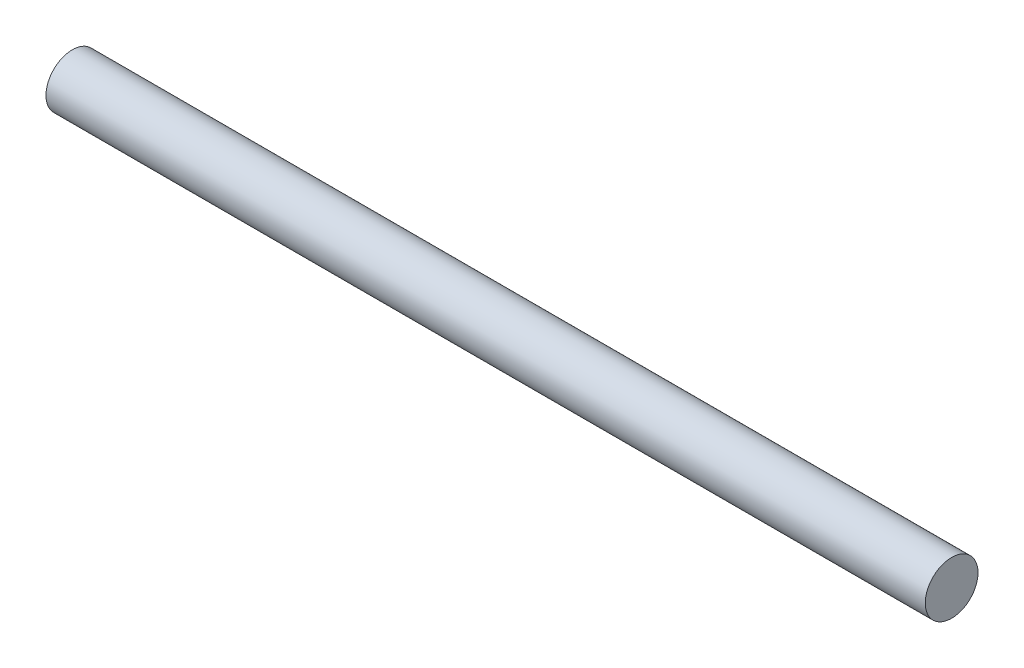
SolidWorks part; units mm, degrees
ref_plane "Front Plane" through (0, 0, 0) normal (0, 0, 1) x (1, 0, 0)
ref_plane "Top Plane" through (0, 0, 0) normal (0, 1, 0) x (1, 0, 0)
ref_plane "Right Plane" through (0, 0, 0) normal (1, 0, 0) x (0, 0, -1)
sketch "Sketch1" plane through (0, 0, 0) normal (1, 0, 0) x (0, 0, -1)
  circle A0 centre (0, 0) radius 1.5
  dimension "D1" = 3
extrude "Boss-Extrude1" add sketch "Sketch1" along normal mid plane 50
